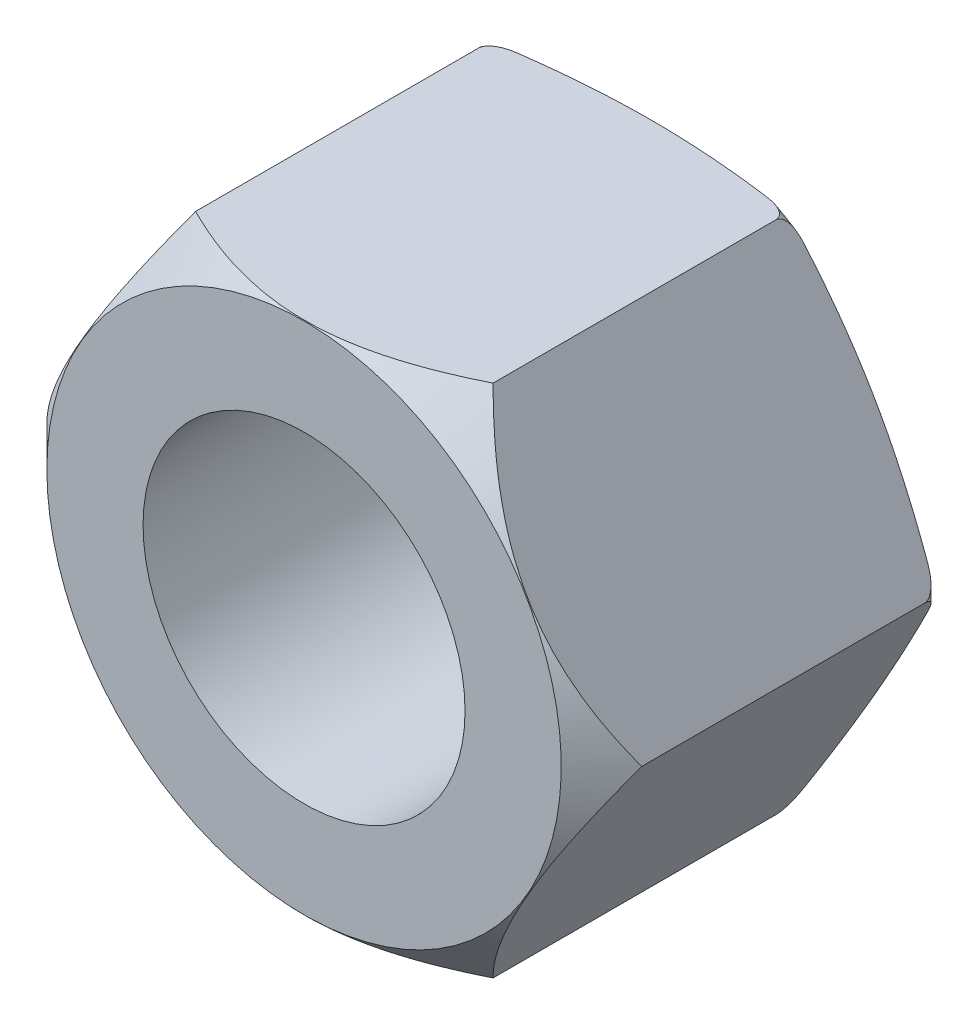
SolidWorks part; units mm, degrees
ref_plane "Plan de face" through (0, 0, 0) normal (0, 0, 1) x (1, 0, 0)
ref_plane "Plan de dessus" through (0, 0, 0) normal (0, 1, 0) x (1, 0, 0)
ref_plane "Plan de droite" through (0, 0, 0) normal (1, 0, 0) x (0, 0, -1)
sketch "Esquisse1" plane through (0, 0, 0) normal (0, 0, 1) x (1, 0, 0)
  line L1 (9.2376, 0) -> (4.6188, 8)
  line L2 (4.6188, 8) -> (-4.6188, 8)
  line L3 (-4.6188, 8) -> (-9.2376, 0)
  line L4 (-9.2376, 0) -> (-4.6188, -8)
  line L5 (-4.6188, -8) -> (4.6188, -8)
  line L6 (4.6188, -8) -> (9.2376, 0)
  circle A0 centre (0, 0) radius 8 construction
  dimension "D1" = 16
extrude "Boss.-Extru.1" add sketch "Esquisse1" along normal blind 12.4
sketch "Esquisse2" plane through (0, 0, 12.4) normal (0, 0, 1) x (1, 0, 0)
  circle A0 centre (0, 0) radius 5
  dimension "D1" = 10
extrude "Enlèv. mat.-Extru.1" cut sketch "Esquisse2" against normal through all
sketch "Esquisse4" plane through (0, 0, 0) normal (0, 1, 0) x (1, 0, 0)
  line L0 (-9.2376, -11.15) -> (-7.9876, -12.4)
  line L1 (-9.2376, -11.15) -> (-9.8592, -11.15)
  line L2 (-9.2376, -12.4) -> (-9.2376, 0) construction
  line L3 (-5.8447, -0.3787) -> (-5.9317, -0.7267)
  line L4 (-4.6188, -12.4) -> (-9.2376, -12.4) construction
  line L5 (-9.8592, -11.15) -> (-9.8592, -13.3045)
  line L6 (-9.8592, -13.3045) -> (-7.9876, -13.3045)
  line L7 (-7.9876, -13.3045) -> (-7.9876, -12.4)
  line L8 (-4.6188, 0) -> (-9.2376, 0) construction
  line L9 (-6.2692, -1.0831) -> (-8.8852, -1.8911)
  line L10 (-9.2376, -2.3689) -> (-9.2376, -2.9859)
  line L11 (-9.2376, -2.9859) -> (-9.8592, -2.9859)
  line L12 (-9.8592, -2.9859) -> (-9.8592, 0.7796)
  line L13 (-9.8592, 0.7796) -> (-4.8559, 0.7796)
  line L14 (-4.8559, 0.7796) -> (-5, 0.7796)
  line L15 (-5, 0.7796) -> (-5, 0)
  line L16 (-5, 0) -> (-5.3596, 0)
  line L17 (0, 0.3996) -> (0, -12.6586) construction
  arc A0 (-8.8852, -1.8911) -> (-9.2376, -2.3689) centre (-8.7376, -2.3689) ccw
  arc A1 (-5.9317, -0.7267) -> (-6.2692, -1.0831) centre (-6.4167, -0.6054) cw
  arc A2 (-5.8447, -0.3787) -> (-5.3596, 0) centre (-5.3596, -0.5) cw
  point P24 (-9.2376, -2)
  point P27 (-6, -1)
  point P30 (-5.75, 0)
  dimension "D8" = 0.5
  dimension "D1" = 1.25
  dimension "D2" = 1.25
  dimension "D3" = 5
  dimension "D4" = 5.75
  dimension "D5" = 6
  dimension "D6" = 0.6054
  dimension "D7" = 1
revolve "Enlèvement de matière-Révolution3" cut sketch "Esquisse4" angle 360 about L17
